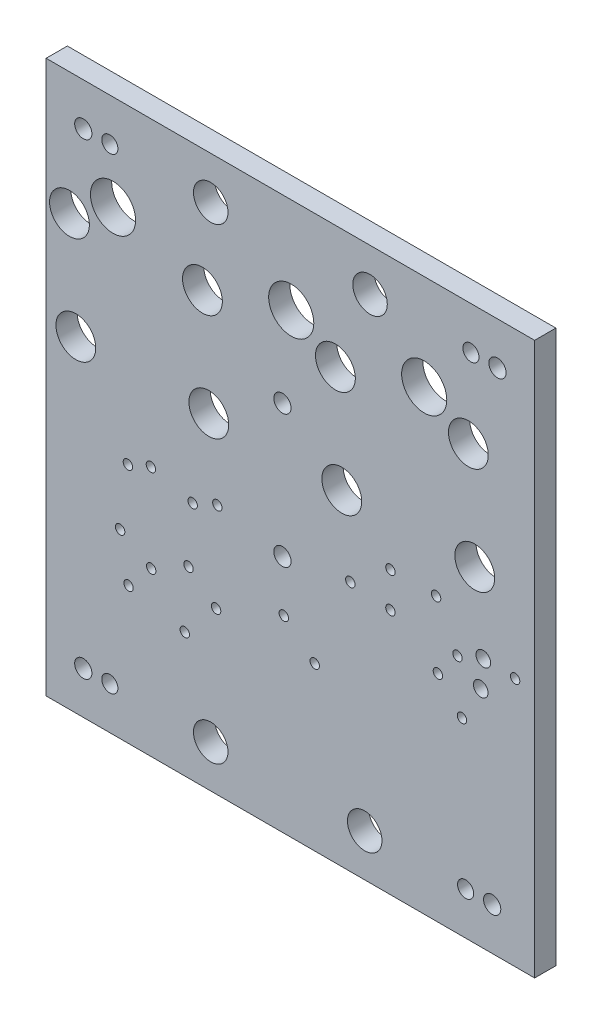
SolidWorks part; units mm, degrees
ref_plane "Front" through (0, 0, 0) normal (0, 0, 1) x (1, 0, 0)
ref_plane "Top" through (0, 0, 0) normal (0, 1, 0) x (1, 0, 0)
ref_plane "Right" through (0, 0, 0) normal (1, 0, 0) x (0, 0, -1)
sketch "Sketch1" plane through (0, 0, 0) normal (0, 0, 1) x (1, 0, 0)
  line L4 (-744.22, -180.975) -> (-452.12, -180.975)
  line L5 (-744.22, 149.225) -> (-744.22, -180.975)
  line L6 (-452.12, 149.225) -> (-744.22, 149.225)
  line L7 (-452.12, -180.975) -> (-452.12, 149.225)
  line L8 (-744.22, -180.975) -> (-452.12, -180.975)
  line L9 (-744.22, 149.225) -> (-744.22, -180.975)
  line L10 (-452.12, 149.225) -> (-744.22, 149.225)
  line L11 (-452.12, -180.975) -> (-452.12, 149.225)
  dimension "D1" = 0
extrude "Boss-Extrude1" add sketch "Sketch1" along normal blind 12.7 separate body
hole_wizard "Hole1" positions "Point_Sketch" profile "Profil_Sketch" hole size "Ø0.15" standard "ISO"
sketch "Point_Sketch" plane through (-426.2468, 98.1359, 12.7) normal (0, 0, -1) x (1, 0, 0)
  point P0 (-91.9132, 6.0609)
  point P2 (-171.4152, 6.0609)
  point P4 (-277.9682, 6.0609)
sketch "Profil_Sketch" plane through (-518.16, 92.075, 12.7) normal (1, 0, 0) x (0, -1, 0)
  line L0 (0, 0) -> (0, 12.7)
  line L1 (0, 12.7) -> (13.4937, 12.7)
  line L2 (13.4937, 12.7) -> (13.4937, 0)
  line L5 (13.4937, 0) -> (0, 0)
  line L11 (0, -6.35) -> (0, 107.95) construction
  dimension "Diameter" = 26.9875
  dimension "Thru Hole Depth" = 12.7
other "usin_DL090<1>"
hole_wizard "Hole11" positions "Point_Sketch1" profile "Profil_Sketch1" hole size "Ø0.15" standard "ISO"
sketch "Point_Sketch1" plane through (-488.0897, 86.4963, 0) normal (0, 0, 1) x (-1, 0, 0)
  point P0 (3.6543, 10.6011)
  point P4 (79.3463, 72.5263)
  point P6 (83.1563, 10.6011)
  point P8 (162.6583, 10.6011)
  point P10 (158.8483, 72.5263)
  point P12 (242.1603, 10.6011)
  point P14 (238.3503, 72.5263)
  point P16 (-0.1557, 72.5263)
sketch "Profil_Sketch1" plane through (-491.744, 75.8952, 0) normal (1, 0, 0) x (0, 1, 0)
  line L0 (0, 0) -> (0, 12.7)
  line L1 (0, 12.7) -> (11.9062, 12.7)
  line L2 (11.9062, 12.7) -> (11.9062, 0)
  line L5 (11.9062, 0) -> (0, 0)
  line L11 (0, -6.35) -> (0, 107.95) construction
  dimension "Diameter" = 23.8125
  dimension "Thru Hole Depth" = 12.7
other "usin_DL090<2>"
hole_wizard "Hole12" positions "Point_Sketch2" profile "Profil_Sketch2" hole size "Ø0.15" standard "ISO"
sketch "Point_Sketch2" plane through (-501.896, -26.5953, 12.7) normal (0, 0, -1) x (1, 0, 0)
  point P0 (3.6543, 10.6011)
  point P2 (-8.0741, 25.6127)
sketch "Profil_Sketch2" plane through (-498.2418, -37.1964, 12.7) normal (1, 0, 0) x (0, -1, 0)
  line L0 (0, 0) -> (0, 12.7)
  line L1 (0, 12.7) -> (2.8067, 12.7)
  line L2 (2.8067, 12.7) -> (2.8067, 0)
  line L5 (2.8067, 0) -> (0, 0)
  line L11 (0, -6.35) -> (0, 107.95) construction
  dimension "Diameter" = 5.6134
  dimension "Thru Hole Depth" = 12.7
other "usin_DL090_10-24x1.75-SHCS<3>"
hole_wizard "Hole13" positions "Point_Sketch3" profile "Profil_Sketch3" hole size "Ø0.15" standard "ISO"
sketch "Point_Sketch3" plane through (-542.0004, -2.0467, 12.7) normal (0, 0, -1) x (1, 0, 0)
  point P0 (3.6543, 10.6011)
  point P2 (3.6543, 31.5561)
  point P4 (30.9593, 10.6011)
sketch "Profil_Sketch3" plane through (-538.3462, -12.6478, 12.7) normal (1, 0, 0) x (0, -1, 0)
  line L0 (0, 0) -> (0, 12.7)
  line L1 (0, 12.7) -> (2.8067, 12.7)
  line L2 (2.8067, 12.7) -> (2.8067, 0)
  line L5 (2.8067, 0) -> (0, 0)
  line L11 (0, -6.35) -> (0, 107.95) construction
  dimension "Diameter" = 5.6134
  dimension "Thru Hole Depth" = 12.7
other "usin_DL090_10-24x1.75-SHCS<4>"
hole_wizard "Hole14" positions "Point_Sketch4" profile "Profil_Sketch4" hole size "Ø0.15" standard "ISO"
sketch "Point_Sketch4" plane through (-605.7682, -57.7567, 12.7) normal (0, 0, -1) x (1, 0, 0)
  point P0 (3.6624, 10.5914)
  point P2 (22.1471, 26.1019)
  point P4 (43.4444, -26.7481)
sketch "Profil_Sketch4" plane through (-602.1058, -68.3481, 12.7) normal (1, 0, 0) x (0, -1, 0)
  line L0 (0, 0) -> (0, 12.7)
  line L1 (0, 12.7) -> (2.8067, 12.7)
  line L2 (2.8067, 12.7) -> (2.8067, 0)
  line L5 (2.8067, 0) -> (0, 0)
  line L11 (0, -6.35) -> (0, 107.95) construction
  dimension "Diameter" = 5.6134
  dimension "Thru Hole Depth" = 12.7
other "usin_DL090_10-24x1.75-SHCS<5>"
hole_wizard "Hole15" positions "Point_Sketch5" profile "Profil_Sketch5" hole size "Ø0.15" standard "ISO"
sketch "Point_Sketch5" plane through (-664.965, -95.8405, 12.7) normal (0, 0, -1) x (1, 0, 0)
  point P0 (3.6543, 10.6011)
  point P2 (22.3906, -10.9738)
sketch "Profil_Sketch5" plane through (-661.3107, -106.4416, 12.7) normal (1, 0, 0) x (0, -1, 0)
  line L0 (0, 0) -> (0, 12.7)
  line L1 (0, 12.7) -> (2.8067, 12.7)
  line L2 (2.8067, 12.7) -> (2.8067, 0)
  line L5 (2.8067, 0) -> (0, 0)
  line L11 (0, -6.35) -> (0, 107.95) construction
  dimension "Diameter" = 5.6134
  dimension "Thru Hole Depth" = 12.7
other "usin_DL090_10-24x1.75-SHCS<6>"
hole_wizard "Hole16" positions "Point_Sketch6" profile "Profil_Sketch6" hole size "Ø0.15" standard "ISO"
sketch "Point_Sketch6" plane through (-662.7256, -60.8189, 12.7) normal (0, 0, -1) x (1, 0, 0)
  point P0 (3.6543, 10.6011)
  point P2 (6.1356, -23.4891)
  point P4 (20.8998, -29.8103)
sketch "Profil_Sketch6" plane through (-659.0714, -71.4201, 12.7) normal (1, 0, 0) x (0, -1, 0)
  line L0 (0, 0) -> (0, 12.7)
  line L1 (0, 12.7) -> (2.8067, 12.7)
  line L2 (2.8067, 12.7) -> (2.8067, 0)
  line L5 (2.8067, 0) -> (0, 0)
  line L11 (0, -6.35) -> (0, 107.95) construction
  dimension "Diameter" = 5.6134
  dimension "Thru Hole Depth" = 12.7
other "usin_DL090_10-24x1.75-SHCS<7>"
hole_wizard "Hole17" positions "Point_Sketch7" profile "Profil_Sketch7" hole size "Ø0.15" standard "ISO"
sketch "Point_Sketch7" plane through (-685.0515, -72.969, 12.7) normal (0, 0, -1) x (1, 0, 0)
  point P0 (3.6543, 10.6011)
  point P2 (-9.8775, 26.1831)
sketch "Profil_Sketch7" plane through (-681.3972, -83.5701, 12.7) normal (1, 0, 0) x (0, -1, 0)
  line L0 (0, 0) -> (0, 12.7)
  line L1 (0, 12.7) -> (2.8067, 12.7)
  line L2 (2.8067, 12.7) -> (2.8067, 0)
  line L5 (2.8067, 0) -> (0, 0)
  line L11 (0, -6.35) -> (0, 107.95) construction
  dimension "Diameter" = 5.6134
  dimension "Thru Hole Depth" = 12.7
other "usin_DL090_10-24x1.75-SHCS<8>"
hole_wizard "Hole18" positions "Point_Sketch8" profile "Profil_Sketch8" hole size "Ø0.15" standard "ISO"
sketch "Point_Sketch8" plane through (-698.9793, -26.0937, 12.7) normal (0, 0, -1) x (1, 0, 0)
  point P0 (3.6543, 10.6011)
  point P2 (17.4025, 4.9149)
  point P4 (-0.9904, 46.5166)
sketch "Profil_Sketch8" plane through (-695.325, -36.6949, 12.7) normal (1, 0, 0) x (0, -1, 0)
  line L0 (0, 0) -> (0, 12.7)
  line L1 (0, 12.7) -> (2.8067, 12.7)
  line L2 (2.8067, 12.7) -> (2.8067, 0)
  line L5 (2.8067, 0) -> (0, 0)
  line L11 (0, -6.35) -> (0, 107.95) construction
  dimension "Diameter" = 5.6134
  dimension "Thru Hole Depth" = 12.7
other "usin_DL090_10-24x1.75-SHCS<9>"
hole_wizard "Hole19" positions "Point_Sketch9" profile "Profil_Sketch9" hole size "Ø0.15" standard "ISO"
sketch "Point_Sketch9" plane through (-497.0447, -55.8196, 12.7) normal (0, 0, -1) x (1, 0, 0)
  point P0 (1.476, 12.2087)
  point P2 (33.2495, -24.0696)
sketch "Profil_Sketch9" plane through (-495.5687, -68.0284, 12.7) normal (1, 0, 0) x (0, -1, 0)
  line L0 (0, 0) -> (0, 12.7)
  line L1 (0, 12.7) -> (2.8067, 12.7)
  line L2 (2.8067, 12.7) -> (2.8067, 0)
  line L5 (2.8067, 0) -> (0, 0)
  line L11 (0, -6.35) -> (0, 107.95) construction
  dimension "Diameter" = 5.6134
  dimension "Thru Hole Depth" = 12.7
other "usin_DL090_10-24x1.75-SHCS<10>"
hole_wizard "Hole110" positions "Point_Sketch10" profile "Profil_Sketch10" hole size "Ø0.15" standard "ISO"
sketch "Point_Sketch10" plane through (-477.9993, -144.9739, 12.7) normal (0, 0, -1) x (1, 0, 0)
  point P0 (0.4793, 10.6011)
  point P2 (3.6543, -268.7989)
  point P4 (-243.9957, -268.7989)
  point P6 (-243.9957, 10.6011)
  point P8 (-124.9332, -186.2489)
  point P10 (-124.9332, -106.8739)
sketch "Profil_Sketch10" plane through (-477.52, -155.575, 12.7) normal (1, 0, 0) x (0, -1, 0)
  line L0 (0, 0) -> (0, 12.7)
  line L1 (0, 12.7) -> (5.1562, 12.7)
  line L2 (5.1562, 12.7) -> (5.1562, 0)
  line L5 (5.1562, 0) -> (0, 0)
  line L11 (0, -6.35) -> (0, 107.95) construction
  dimension "Diameter" = 10.3124
  dimension "Thru Hole Depth" = 12.7
other "usin_DL090_.375-16x1.75-SHCS<11>"
hole_wizard "Hole111" positions "Point_Sketch11" profile "Profil_Sketch11" hole size "Ø0.15" standard "ISO"
sketch "Point_Sketch11" plane through (-665.3243, 134.4261, 12.7) normal (0, 0, -1) x (1, 0, 0)
  point P0 (19.5293, 10.6011)
  point P2 (114.7793, 10.6011)
  point P4 (111.6043, 290.0011)
  point P6 (19.5293, 290.0011)
sketch "Profil_Sketch11" plane through (-645.795, 123.825, 12.7) normal (1, 0, 0) x (0, -1, 0)
  line L0 (0, 0) -> (0, 12.7)
  line L1 (0, 12.7) -> (10.3187, 12.7)
  line L2 (10.3187, 12.7) -> (10.3187, 0)
  line L5 (10.3187, 0) -> (0, 0)
  line L11 (0, -6.35) -> (0, 107.95) construction
  dimension "Diameter" = 20.6375
  dimension "Thru Hole Depth" = 12.7
other "usin_DL090<12>"
hole_wizard "Hole112" positions "Point_Sketch12" profile "Profil_Sketch12" hole size "Ø0.15" standard "ISO"
sketch "Point_Sketch12" plane through (-492.9157, -144.9739, 0) normal (0, 0, 1) x (-1, 0, 0)
  point P0 (0.4793, 10.6011)
  point P2 (213.2043, 10.6011)
  point P4 (213.2043, -268.7989)
  point P6 (-2.6957, -268.7989)
sketch "Profil_Sketch12" plane through (-493.395, -155.575, 0) normal (1, 0, 0) x (0, 1, 0)
  line L0 (0, 0) -> (0, 12.7)
  line L1 (0, 12.7) -> (4.826, 12.7)
  line L2 (4.826, 12.7) -> (4.826, 0)
  line L5 (4.826, 0) -> (0, 0)
  line L11 (0, -6.35) -> (0, 107.95) construction
  dimension "Diameter" = 9.652
  dimension "Thru Hole Depth" = 12.7
other "usin_DL090_.375 x 2.00 DOWEL PIN<13>"
hole_wizard "Hole113" positions "Point_Sketch13" profile "Profil_Sketch13" hole size "Ø0.15" standard "ISO"
sketch "Point_Sketch13" plane through (-488.001, -36.3259, 12.7) normal (0, 0, -1) x (1, 0, 0)
  point P0 (3.6543, 10.9736)
  point P2 (5.1792, -5.3173)
sketch "Profil_Sketch13" plane through (-484.3468, -47.2994, 12.7) normal (1, 0, 0) x (0, -1, 0)
  line L0 (0, 0) -> (0, 12.7)
  line L1 (0, 12.7) -> (4.3656, 12.7)
  line L2 (4.3656, 12.7) -> (4.3656, 0)
  line L5 (4.3656, 0) -> (0, 0)
  line L11 (0, -6.35) -> (0, 107.95) construction
  dimension "Diameter" = 8.7312
  dimension "Thru Hole Depth" = 12.7
other "usin_DL090<14>"
